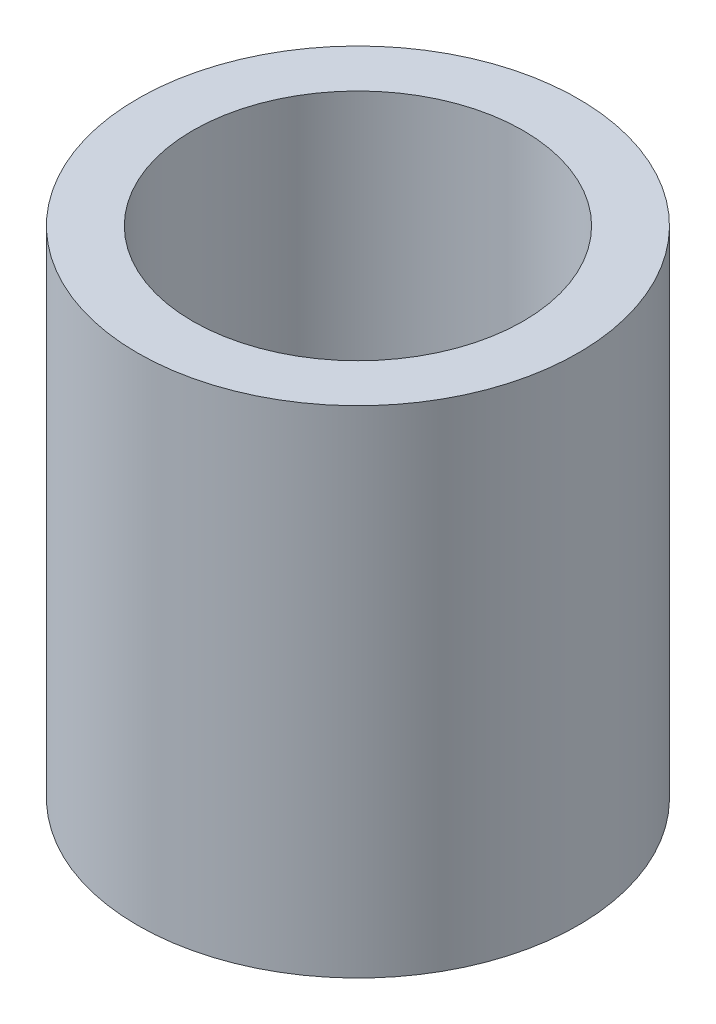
SolidWorks part; units mm, degrees
ref_plane "Front Plane" through (0, 0, 0) normal (0, 0, 1) x (1, 0, 0)
ref_plane "Top Plane" through (0, 0, 0) normal (0, 1, 0) x (1, 0, 0)
ref_plane "Right Plane" through (0, 0, 0) normal (1, 0, 0) x (0, 0, -1)
sketch "Sketch1" plane through (0, 0, 0) normal (0, 1, 0) x (1, 0, 0)
  circle A0 centre (0, 0) radius 1.5
  circle A1 centre (0, 0) radius 2
  dimension "D1" = 3
  dimension "D2" = 4
extrude "Boss-Extrude1" add sketch "Sketch1" along normal blind 4.5
sketch "Sketch2" plane through (0, 0, 0) normal (0, -1, 0) x (1, 0, 0)
  line L0 (0, 0) -> (0, 2) construction
  circle A0 centre (0, 0) radius 2 construction
